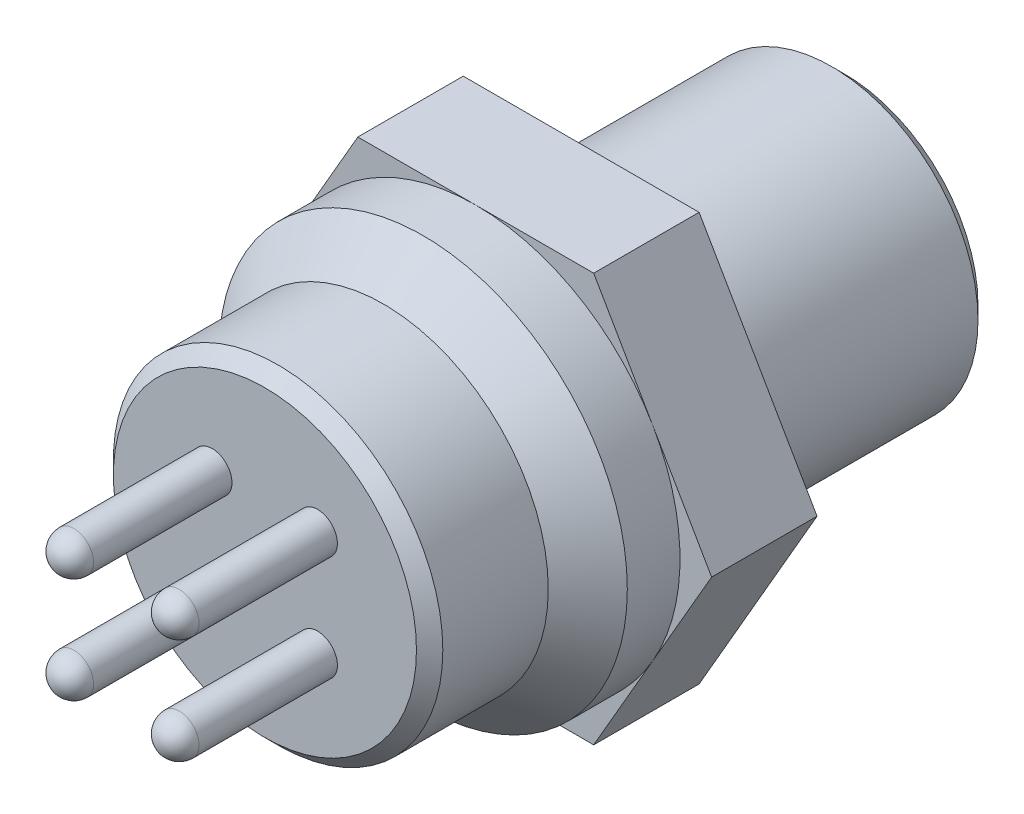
SolidWorks part; units mm, degrees
ref_plane "Front" through (0, 0, 0) normal (0, 0, 1) x (1, 0, 0)
ref_plane "Top" through (0, 0, 0) normal (0, 1, 0) x (1, 0, 0)
ref_plane "Right" through (0, 0, 0) normal (1, 0, 0) x (0, 0, -1)
sketch "Sketch1" plane through (0, 0, 0) normal (0, 0, 1) x (1, 0, 0)
  circle A0 centre (0, 0) radius 5.5562
  dimension "D1" = 11.1125
extrude "Base-Extrude" add sketch "Sketch1" along normal blind 10
sketch "Sketch2" plane through (0, 0, 10) normal (0, 0, 1) x (1, 0, 0)
  line L1 (8.9489, 0) -> (4.4745, 7.75)
  line L2 (4.4745, 7.75) -> (-4.4745, 7.75)
  line L3 (-4.4745, 7.75) -> (-8.9489, 0)
  line L4 (-8.9489, 0) -> (-4.4745, -7.75)
  line L5 (-4.4745, -7.75) -> (4.4745, -7.75)
  line L6 (4.4745, -7.75) -> (8.9489, 0)
  circle A0 centre (0, 0) radius 7.75 construction
  dimension "D1" = 15.5
extrude "Boss-Extrude1" add sketch "Sketch2" along normal blind 4
sketch "Sketch3" plane through (0, 0, 14) normal (0, 0, 1) x (1, 0, 0)
  line L0 (4.4745, 7.75) -> (-4.4745, 7.75) construction
  circle A0 centre (0, 0) radius 7.75
extrude "Boss-Extrude2" add sketch "Sketch3" along normal blind 8
sketch "Sketch4" plane through (0, 0, 22) normal (0, 0, 1) x (1, 0, 0)
  line L0 (0, 0) -> (0, -13.395) construction
  line L1 (0, 0) -> (15.1551, 0) construction
  circle A0 centre (-2, 2) radius 0.75
  circle A1 centre (2, 2) radius 0.75
  circle A2 centre (-2, -2) radius 0.75
  circle A3 centre (2, -2) radius 0.75
  dimension "D3" = 1.5
  dimension "D1" = 2
  dimension "D2" = 2
extrude "Boss-Extrude3" add sketch "Sketch4" along normal blind 6
fillet "Fillet1" radius 0.75 4 edges at (-2.75, -2, 28) (-1.25, 2, 28) (1.25, 2, 28) (2.75, -2, 28)
sketch "Sketch5" plane through (0, 0, 22) normal (0, 0, 1) x (1, 0, 0)
  circle A0 centre (0, 0) radius 6.25
  circle A1 centre (0, 0) radius 11
  dimension "D1" = 22
  dimension "D2" = 12.5
extrude "Cut-Extrude1" cut sketch "Sketch5" against normal blind 6
chamfer "Chamfer2" distance 1.5 angle 45 1 edges at (6.25, 0, 16)
chamfer "Chamfer3" distance 0.5 angle 45 2 edges at (5.5562, 0, 0) (6.25, 0, 22)
sketch "Sketch6" plane through (0, 0, 0) normal (0, 1, 0) x (1, 0, 0)
  line L0 (-4.4745, -10) -> (-8.9489, -10) construction
  line L1 (-7, -10) -> (-5.5, -10)
  line L2 (-7, -10) -> (-7, -11.5)
  line L3 (-7, -11.5) -> (-5.5, -11.5)
  line L4 (-5.5, -10) -> (-5.5, -11.5)
  line L5 (0, 0) -> (0, -46.1923) construction
  line L6 (0, -16) -> (0, -14) construction
  dimension "D1" = 11
  dimension "D2" = 14
  dimension "D3" = 1.5
sketch "Sketch7" plane through (0, 0, 10) normal (0, 0, -1) x (-1, 0, 0)
  circle A0 centre (0, 0) radius 6.148
  dimension "D1" = 12.2959
sweep "Cut-Sweep1" cut profiles "Sketch6" path "Sketch7"
